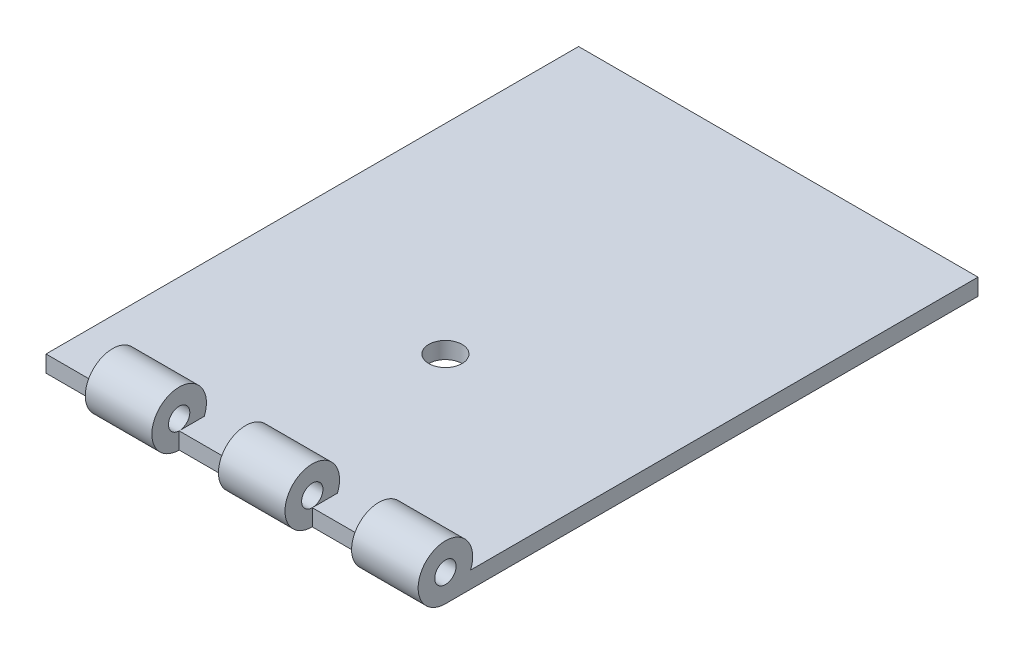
SolidWorks part; units mm, degrees
ref_plane "Front Plane" through (0, 0, 0) normal (0, 0, 1) x (1, 0, 0)
ref_plane "Top Plane" through (0, 0, 0) normal (0, 1, 0) x (1, 0, 0)
ref_plane "Right Plane" through (0, 0, 0) normal (1, 0, 0) x (0, 0, -1)
sketch "Sketch1" plane through (0, 0, 0) normal (0, 1, 0) x (1, 0, 0)
  line L0 (19.05, 12.7) -> (-19.05, -38.1) construction
  line L1 (-19.05, -38.1) -> (19.05, -38.1)
  line L2 (-19.05, -38.1) -> (-19.05, 12.7)
  line L3 (-19.05, 12.7) -> (19.05, 12.7)
  line L4 (19.05, -38.1) -> (19.05, 12.7)
  line L5 (19.05, -38.1) -> (-19.05, 12.7) construction
  point P0 (0, 0)
  point P6 (0, -12.7)
  dimension "D1" = 50.8
  dimension "D2" = 38.1
  dimension "D3" = 12.7
extrude "Boss-Extrude1" add sketch "Sketch1" along normal blind 1.5875
sketch "Sketch2" plane through (19.05, 0, 0) normal (1, 0, 0) x (0, 0, -1)
  circle A0 centre (-38.1, 2.6035) radius 1.016
  circle A1 centre (-38.1, 2.6035) radius 2.6035
extrude "Boss-Extrude2" add sketch "Sketch2" against normal blind 6.35
sketch "Sketch3" plane through (0, 1.5875, 0) normal (0, 1, 0) x (1, 0, 0)
  line L0 (23.6109, -39.2348) -> (-22.4212, -39.2348) construction
pattern_linear "LPattern1" count 3 spacing 12.7 along (-1, 0, 0) of "Boss-Extrude2"
sketch "Sketch5" plane through (0, 1.5875, 0) normal (0, 1, 0) x (1, 0, 0)
  line L0 (0, -27.1548) -> (0, 32.6046) construction
  circle A0 centre (0, 25.4) radius 1.5875
  circle A1 centre (0, -19.05) radius 1.5875
  dimension "D1" = 25.4
  dimension "D2" = 19.05
extrude "Cut-Extrude1" cut sketch "Sketch5" against normal through all both and the other way through all
